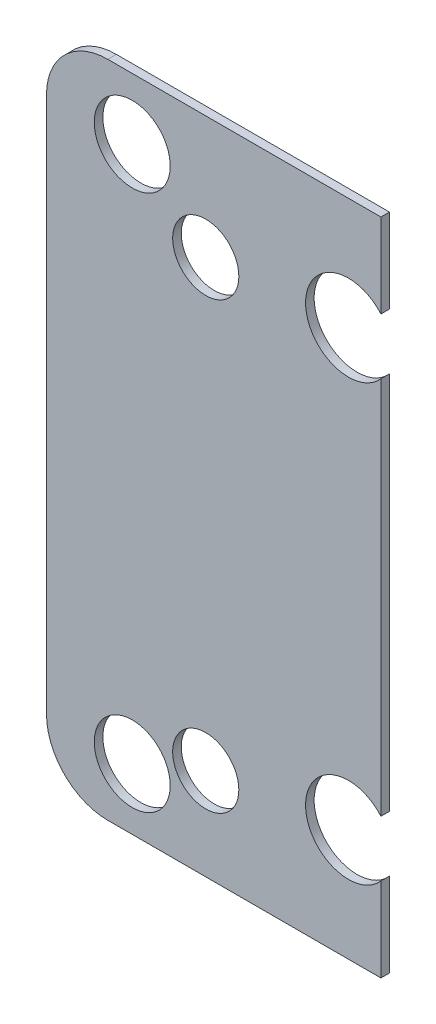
SolidWorks part; units mm, degrees
ref_plane "前基準面" through (0, 0, 0) normal (0, 0, 1) x (1, 0, 0)
ref_plane "上基準面" through (0, 0, 0) normal (0, 1, 0) x (1, 0, 0)
ref_plane "右基準面" through (0, 0, 0) normal (1, 0, 0) x (0, 0, -1)
sketch "草圖1" plane through (0, 0, 0) normal (0, 0, 1) x (1, 0, 0)
  line L1 (-38, 30) -> (38, 30)
  line L2 (-38, 30) -> (-38, -30)
  line L3 (-38, -30) -> (38, -30)
  line L4 (38, 30) -> (38, -30)
  line L5 (-38, 30) -> (38, -30) construction
  line L6 (-38, -30) -> (38, 30) construction
  point P0 (0, 0)
  point P28 (0, 0)
  dimension "D1" = 76
  dimension "D2" = 60
extrude "填料-伸長1" add sketch "草圖1" along normal blind 0.7
sketch "草圖2" plane through (0, 0, 0.7) normal (0, 0, 1) x (1, 0, 0)
  line L6 (0.3574, 0.005) -> (20.1903, 2.4807) construction
  line L7 (0.3574, -0.005) -> (20.1903, -2.4807) construction
  line L8 (0.3574, 0.005) -> (4.5094, 0.5233)
  line L9 (0.3574, -0.005) -> (4.5094, -0.5233)
  line L10 (6.1751, 0.8773) -> (19.0478, 4.7845)
  line L11 (6.1751, -0.8773) -> (19.0478, -4.7845)
  line L12 (-2.3278, -5.7864) -> (-5.3804, -18.8881)
  line L13 (-0.1744, -0.312) -> (-1.8015, -4.1669)
  line L14 (-0.183, -0.307) -> (-2.7079, -3.6436)
  line L15 (-3.8473, -4.9091) -> (-13.6674, -14.1037)
  line L16 (-3.8473, 4.9091) -> (-13.6674, 14.1037)
  line L17 (-0.183, 0.307) -> (-2.7079, 3.6436)
  line L18 (-0.1744, 0.312) -> (-1.8015, 4.1669)
  line L19 (-2.3278, 5.7864) -> (-5.3804, 18.8881)
  circle A7 centre (0, 0) radius 0.353 construction
  arc A8 (0.3574, 0.005) -> (0.3574, -0.005) centre (0.358, 0) ccw
  arc A9 (19.0478, -4.7845) -> (19.0478, 4.7845) centre (20.5, 0) ccw
  circle A10 centre (20.5, 0) radius 2.5 construction
  arc A11 (4.5094, -0.5233) -> (6.1751, -0.8773) centre (3.2707, -10.4463) cw
  arc A12 (4.5094, 0.5233) -> (6.1751, 0.8773) centre (3.2707, 10.4463) ccw
  arc A13 (-13.6674, -14.1037) -> (-5.3804, -18.8881) centre (-10.25, -17.7535) ccw
  arc A14 (-1.8015, -4.1669) -> (-2.3278, -5.7864) centre (7.4114, -8.0556) ccw
  arc A15 (-0.1744, -0.312) -> (-0.183, -0.307) centre (-0.179, -0.31) ccw
  arc A16 (-2.7079, -3.6436) -> (-3.8473, -4.9091) centre (-10.6821, 2.3906) cw
  arc A17 (-5.3804, 18.8881) -> (-13.6674, 14.1037) centre (-10.25, 17.7535) ccw
  arc A18 (-2.7079, 3.6436) -> (-3.8473, 4.9091) centre (-10.6821, -2.3906) ccw
  arc A19 (-0.183, 0.307) -> (-0.1744, 0.312) centre (-0.179, 0.31) ccw
  arc A20 (-1.8015, 4.1669) -> (-2.3278, 5.7864) centre (7.4114, 8.0556) cw
  point P17 (5.3574, -0.6291)
  point P20 (5.3574, 0.6291)
  point P46 (0, 0)
  dimension "D1" = 0.706
  dimension "D2" = 0.01
  dimension "D3" = 10
  dimension "D6" = 5
  dimension "D4" = 5
  dimension "D7" = 10
  dimension "D9" = 0.6201
  dimension "D5" = 20.5
  dimension "D8" = 3
sketch "草圖5" plane through (0, 0, 0.7) normal (0, 0, 1) x (1, 0, 0)
  line L0 (-29.9, 26.9) -> (29.9, 26.9)
  line L1 (-38, 30) -> (-38, -30) construction
  line L2 (38, -30) -> (38, 30) construction
  line L3 (34.9, 21.9) -> (34.9, -21.9)
  line L4 (38, 30) -> (-38, 30) construction
  line L5 (-38, -30) -> (38, -30) construction
  line L6 (-29.9, -26.9) -> (29.9, -26.9)
  line L7 (-34.9, 21.9) -> (-34.9, -21.9)
  arc A0 (-29.9, -26.9) -> (-34.9, -21.9) centre (-29.9, -21.9) cw
  arc A1 (34.9, -21.9) -> (29.9, -26.9) centre (29.9, -21.9) cw
  arc A2 (29.9, 26.9) -> (34.9, 21.9) centre (29.9, 21.9) cw
  arc A3 (-34.9, 21.9) -> (-29.9, 26.9) centre (-29.9, 21.9) cw
  dimension "D5" = 5
  dimension "D1" = 3.1
  dimension "D2" = 3.1
  dimension "D3" = 3.1
  dimension "D4" = 3.1
extrude "除料-伸長4" cut sketch "草圖5" against normal blind 10 contours L7 A3 L0 A2 L3 A1 L6 A0 M32 M29 M30 M31
ref_plane "平面1" through (0, 0, 0.7) normal (0, 0, 1) x (1, 0, 0)
sketch "草圖9" plane through (0, 0, 0.7) normal (0, 0, 1) x (1, 0, 0)
  line L0 (34.9, 21.9) -> (24.9, 21.9) construction
  line L1 (24.9, 21.9) -> (24.9, -21.9) construction
  line L2 (24.9, -21.9) -> (34.9, -21.9) construction
  line L3 (34.9, 21.9) -> (34.9, -21.9) construction
  line L4 (0, 26.9) -> (0, -26.9) construction
  line L5 (-29.9, 26.9) -> (29.9, 26.9) construction
  line L6 (-29.9, -26.9) -> (29.9, -26.9) construction
  line L7 (34.9, 0) -> (-34.9, 0) construction
  line L8 (-34.9, 21.9) -> (-34.9, -21.9) construction
  circle A0 centre (32.1, 17.9) radius 1.5
  circle A3 centre (-32.1, 19.4) radius 1.5
  circle A4 centre (-32.1, -19.4) radius 1.5
  circle A5 centre (32.1, -19.4) radius 1.5
  dimension "D2" = 3
  dimension "D5" = 2.8
  dimension "D3" = 3
  dimension "D7" = 2.8
  dimension "D1" = 10
  dimension "D4" = 4
  dimension "D6" = 2.5
sketch "草圖13" plane through (0, 0, 0.7) normal (0, 0, 1) x (1, 0, 0)
  line L0 (5.358, 0.6292) -> (19.0478, 4.7845) construction
  line L1 (0.3574, 0.005) -> (20.1903, 2.4807) construction
  line L2 (20.1903, -2.4807) -> (0.3574, -0.005) construction
  line L15 (0.3574, 0.005) -> (5.358, 0.6292) construction
  line L16 (0.3574, -0.005) -> (5.358, -0.6292) construction
  line L17 (5.358, -0.6292) -> (19.0478, -4.7845) construction
  line L18 (-2.1341, -4.9548) -> (-5.3804, -18.8881) construction
  line L19 (-0.1744, -0.312) -> (-2.1341, -4.9548) construction
  line L20 (-0.183, -0.307) -> (-3.2239, -4.3256) construction
  line L21 (-3.2239, -4.3256) -> (-13.6673, -14.1036) construction
  line L22 (-3.2239, 4.3256) -> (-13.6673, 14.1036) construction
  line L23 (-0.183, 0.307) -> (-3.2239, 4.3256) construction
  line L24 (-0.1744, 0.312) -> (-2.1341, 4.9548) construction
  line L25 (-2.1341, 4.9548) -> (-5.3804, 18.8881) construction
  line L41 (0.3574, 0.005) -> (6.1962, 1.0512)
  line L42 (0.3574, -0.005) -> (6.1962, -1.0512)
  line L43 (-0.183, -0.307) -> (-4.0085, -4.8405)
  line L44 (-0.1744, -0.312) -> (-2.1877, -5.8917)
  line L45 (-0.1744, 0.312) -> (-2.1877, 5.8917)
  line L46 (-0.183, 0.307) -> (-4.0085, 4.8405)
  circle A8 centre (0, 0) radius 0.353 construction
  arc A9 (0.3574, 0.005) -> (0.3574, -0.005) centre (0.358, 0) ccw construction
  circle A10 centre (20.5, 0) radius 2.5 construction
  arc A11 (19.0478, -4.7845) -> (19.0478, 4.7845) centre (20.5, 0) ccw construction
  arc A12 (-13.6673, -14.1036) -> (-5.3804, -18.8881) centre (-10.25, -17.7535) ccw construction
  arc A13 (-0.1744, -0.312) -> (-0.183, -0.307) centre (-0.179, -0.31) ccw construction
  arc A14 (-5.3804, 18.8881) -> (-13.6673, 14.1036) centre (-10.25, 17.7535) ccw construction
  arc A15 (-0.183, 0.307) -> (-0.1744, 0.312) centre (-0.179, 0.31) ccw construction
  arc A16 (-4.7391, 4.8766) -> (-4.7391, -4.8766) centre (0, 0) ccw
  arc A17 (-0.183, 0.307) -> (-0.1744, 0.312) centre (-0.179, 0.31) ccw
  arc A18 (-0.1744, -0.312) -> (-0.183, -0.307) centre (-0.179, -0.31) ccw
  arc A19 (-1.8537, -6.5425) -> (6.5928, -1.6658) centre (0, 0) ccw
  arc A20 (0.3574, 0.005) -> (0.3574, -0.005) centre (0.358, 0) ccw
  arc A21 (6.5928, 1.6658) -> (-1.8537, 6.5425) centre (0, 0) ccw
  arc A22 (6.1962, -1.0512) -> (6.5928, -1.6658) centre (6.108, -1.5434) cw
  arc A23 (6.1962, 1.0512) -> (6.5928, 1.6658) centre (6.108, 1.5434) ccw
  arc A24 (-2.1877, 5.8917) -> (-1.8537, 6.5425) centre (-1.7174, 6.0614) cw
  arc A25 (-4.0085, 4.8405) -> (-4.7391, 4.8766) centre (-4.3906, 4.518) ccw
  arc A26 (-4.0085, -4.8405) -> (-4.7391, -4.8766) centre (-4.3906, -4.518) cw
  arc A27 (-2.1877, -5.8917) -> (-1.8537, -6.5425) centre (-1.7174, -6.0614) ccw
  point P31 (0, 0)
  point P38 (6.7034, -1.1421)
  point P41 (6.7034, 1.1421)
  point P49 (0, 0)
  dimension "D1" = 0.706
  dimension "D2" = 0.01
  dimension "D3" = 5
  dimension "D6" = 5
  dimension "D5" = 10
  dimension "D8" = 13.6
  dimension "D12" = 0.5
  dimension "D13" = 0.5
  dimension "D4" = 20.5
  dimension "D9" = 0.1
  dimension "D10" = 0.1
  dimension "D11" = 3
  dimension "D7" = 3
extrude "除料-伸長8" cut sketch "草圖13" against normal blind 0.7
sketch "草圖17" plane through (0, 0, 0.7) normal (0, 0, 1) x (1, 0, 0)
  line L0 (-29.9, 26.9) -> (29.9, 26.9) construction
  line L1 (-34.9, 21.9) -> (-34.9, -21.9) construction
  line L2 (0, 26.9) -> (0, -26.9) construction
  line L3 (-29.9, -26.9) -> (29.9, -26.9) construction
  circle A0 centre (-21.9, 16.9) radius 2.5
  circle A1 centre (21.9, 16.9) radius 2.5
  circle A2 centre (-21.9, -19.4) radius 2.5
  dimension "D3" = 5
  dimension "D4" = 5
  dimension "D1" = 10
  dimension "D2" = 13
  dimension "D5" = 7.5
extrude "除料-伸長9" cut sketch "草圖17" against normal through all
sketch "草圖20" plane through (0, 0, 0.7) normal (0, 0, 1) x (1, 0, 0)
  line L0 (20.1903, 2.4807) -> (0.3574, 0.005) construction
  line L1 (0.3574, -0.005) -> (20.1903, -2.4807) construction
  line L2 (0.3574, 0.005) -> (5.358, 0.6292)
  line L3 (0.3574, -0.005) -> (5.358, -0.6292)
  line L4 (5.358, 0.6292) -> (19.0478, 4.7845)
  line L5 (5.358, -0.6292) -> (19.0478, -4.7845)
  line L6 (-0.183, -0.307) -> (-3.2239, -4.3256)
  line L7 (-3.2239, -4.3256) -> (-13.6673, -14.1036)
  line L8 (-2.1341, -4.9548) -> (-5.3804, -18.8881)
  line L9 (-0.1744, -0.312) -> (-2.1341, -4.9548)
  line L10 (-7.9468, -18.7257) -> (-0.1744, -0.312) construction
  line L11 (-0.183, -0.307) -> (-12.2436, -16.245) construction
  line L12 (-0.1744, 0.312) -> (-2.1341, 4.9548)
  line L13 (-2.1341, 4.9548) -> (-5.3804, 18.8881)
  line L14 (-3.2239, 4.3256) -> (-13.6673, 14.1036)
  line L15 (-0.183, 0.307) -> (-3.2239, 4.3256)
  line L16 (-12.2436, 16.245) -> (-0.183, 0.307) construction
  line L17 (-0.1744, 0.312) -> (-7.9468, 18.7257) construction
  circle A0 centre (0, 0) radius 0.353 construction
  arc A1 (0.3574, 0.005) -> (0.3574, -0.005) centre (0.358, 0) ccw
  circle A2 centre (20.5, 0) radius 2.5 construction
  arc A3 (19.0478, -4.7845) -> (19.0478, 4.7845) centre (20.5, 0) ccw
  arc A4 (-0.1744, -0.312) -> (-0.183, -0.307) centre (-0.179, -0.31) ccw
  arc A5 (-13.6673, -14.1036) -> (-5.3804, -18.8881) centre (-10.25, -17.7535) ccw
  circle A6 centre (-10.25, -17.7535) radius 2.5 construction
  arc A7 (-0.183, 0.307) -> (-0.1744, 0.312) centre (-0.179, 0.31) ccw
  arc A8 (-5.3804, 18.8881) -> (-13.6673, 14.1036) centre (-10.25, 17.7535) ccw
  circle A9 centre (-10.25, 17.7535) radius 2.5 construction
  point P38 (0, 0)
  dimension "D1" = 0.706
  dimension "D2" = 0.01
  dimension "D3" = 5
  dimension "D5" = 10
  dimension "D4" = 20.5
  dimension "D6" = 5
  dimension "D7" = 3
ref_plane "平面5" through (0, 0, 0.7) normal (0, 0, 1) x (1, 0, 0)
sketch "草圖29" plane through (0, 0, 0.7) normal (0, 0, 1) x (1, 0, 0)
  line L0 (0, 26.9) -> (0, -26.9) construction
  line L1 (-29.9, 26.9) -> (29.9, 26.9) construction
  line L2 (-29.9, -26.9) -> (29.9, -26.9) construction
  line L3 (-34.9, 0) -> (34.9, 0) construction
  line L4 (-34.9, 21.9) -> (-34.9, -21.9) construction
  line L5 (34.9, 21.9) -> (34.9, -21.9) construction
  circle A0 centre (-27.9, 21.9) radius 3
  circle A1 centre (27.9, 21.9) radius 3
  circle A2 centre (27.9, -21.9) radius 3
  circle A3 centre (-27.9, -21.9) radius 3
  dimension "D1" = 6
  dimension "D2" = 5
  dimension "D3" = 7
extrude "填料-伸長3" add sketch "草圖29" along normal blind 0.6
sketch "草圖31" plane through (0, 0, 0.7) normal (0, 0, 1) x (1, 0, 0)
  line L3 (2.5, 40) -> (-2.5, 40)
  line L5 (-5, 37.5) -> (-5, -37.5)
  line L6 (2.5, -40) -> (-2.5, -40)
  line L10 (5, 37.5) -> (5, -37.5)
  line L18 (0, 40) -> (0, -40)
  line L19 (-5, 0) -> (5, 0)
  line L20 (0.353, 0) -> (0, 0)
  arc A0 (-2.4263, -34.8074) -> (2.5209, -34.8074) centre (0.0473, -34.445) ccw construction
  arc A1 (-2.5, 40) -> (-5, 37.5) centre (-2.5, 37.5) ccw
  arc A2 (-5, -37.5) -> (-2.5, -40) centre (-2.5, -37.5) ccw
  arc A3 (5, -37.5) -> (2.5, -40) centre (2.5, -37.5) cw
  arc A5 (-2.4263, -34.8074) -> (2.5209, -34.8074) centre (0.0473, -34.445) ccw construction
  arc A9 (2.5, 40) -> (5, 37.5) centre (2.5, 37.5) cw
  arc A10 (0.3574, 0.005) -> (0.3574, -0.005) centre (0.358, 0) ccw construction
extrude "除料-伸長18" cut sketch "草圖31" against normal mid plane 10 contours L3 A1 L5 L18 M56 | A9 L3 L18 L10 M56 | L18 L5 M56 M36 M37 M38 M39 M40 M41 M42 | L18 L10 M56 M42 | L18 L5 M30 M31 M32 M33 M34 M35 M36 M52 | L5 L19 L18 M42 M41 M40 M39 M38 M37 M36 | L19 L5 L18 M36 M35 M34 M33 M32 M31 M30 | L19 L18 L10 M30 M28 M27 | L18 L19 L10 M27 M44 M42 | L18 L10 M30 M52 | L5 A2 L6 L18 M52 | A3 L10 L18 L6 M52
sketch "草圖33" plane through (0, 0, 0.7) normal (0, 0, 1) x (1, 0, 0)
  circle A0 centre (-27.9, 21.9) radius 3.2
  circle A1 centre (-27.9, -21.9) radius 3.2
  circle A2 centre (27.9, -21.9) radius 3.2
  circle A3 centre (27.9, 21.9) radius 3.2
  dimension "D1" = 6.4
  dimension "D2" = 6.4
sketch "草圖34" plane through (0, 0, 0.7) normal (0, 0, 1) x (1, 0, 0)
  circle A1 centre (20.5, 0) radius 3
  circle A2 centre (-10.25, 17.7535) radius 3.5
  circle A3 centre (-10.25, -17.7535) radius 3.5
  dimension "D1" = 6
  dimension "D2" = 7
  dimension "D3" = 7
extrude "除料-伸長22" cut sketch "草圖34" against normal mid plane 10 contours A2 | A3 | A1
extrude "除料-伸長23" cut sketch "草圖33" against normal mid plane 10 contours A0 | A3 | A2 | A1
sketch "草圖35" plane through (0, 0, 0.7) normal (0, 0, 1) x (1, 0, 0)
  circle A0 centre (21.9, 16.9) radius 2.6
  circle A1 centre (-21.9, 16.9) radius 2.6
  circle A2 centre (-21.9, -19.4) radius 2.6
extrude "除料-伸長24" cut sketch "草圖35" against normal blind 10
sketch "草圖36" plane through (0, 0, 0.7) normal (0, 0, 1) x (1, 0, 0)
sketch "草圖37" plane through (0, 0, 0.7) normal (0, 0, 1) x (1, 0, 0)
  line L4 (5, 26.9) -> (5, 4.6087)
  line L11 (5, -26.9) -> (29.9, -26.9)
  line L12 (34.9, -21.9) -> (34.9, 21.9)
  line L13 (29.9, 26.9) -> (5, 26.9)
  line L18 (5, -26.9) -> (29.9, -26.9)
  line L19 (34.9, -21.9) -> (34.9, 21.9)
  line L20 (29.9, 26.9) -> (5, 26.9)
  line L38 (5, 26.9) -> (5, 4.6087)
  line L39 (6.1962, 1.0512) -> (0.3574, 0.005)
  line L40 (6.1962, 1.0512) -> (0.3574, 0.005)
  line L41 (0.3574, -0.005) -> (6.1962, -1.0512)
  line L42 (0.3574, -0.005) -> (6.1962, -1.0512)
  line L43 (5, -4.6087) -> (5, -26.9)
  line L44 (5, -4.6087) -> (5, -26.9)
  arc A3 (6.5928, 1.6658) -> (5, 4.6087) centre (0, 0) ccw
  arc A8 (29.9, -26.9) -> (34.9, -21.9) centre (29.9, -21.9) ccw
  arc A9 (34.9, 21.9) -> (29.9, 26.9) centre (29.9, 21.9) ccw
  arc A13 (29.9, -26.9) -> (34.9, -21.9) centre (29.9, -21.9) ccw
  arc A14 (34.9, 21.9) -> (29.9, 26.9) centre (29.9, 21.9) ccw
  arc A27 (6.5928, 1.6658) -> (5, 4.6087) centre (0, 0) ccw
  arc A32 (6.1962, 1.0512) -> (6.5928, 1.6658) centre (6.108, 1.5434) ccw
  arc A33 (6.1962, 1.0512) -> (6.5928, 1.6658) centre (6.108, 1.5434) ccw
  arc A34 (0.3574, 0.005) -> (0.3574, -0.005) centre (0.358, 0) ccw
  arc A35 (0.3574, 0.005) -> (0.3574, -0.005) centre (0.358, 0) ccw
  arc A36 (6.5928, -1.6658) -> (6.1962, -1.0512) centre (6.108, -1.5434) ccw
  arc A37 (6.5928, -1.6658) -> (6.1962, -1.0512) centre (6.108, -1.5434) ccw
  arc A38 (5, -4.6087) -> (6.5928, -1.6658) centre (0, 0) ccw
  arc A39 (5, -4.6087) -> (6.5928, -1.6658) centre (0, 0) ccw
  dimension "D1" = 0
extrude "除料-伸長27" cut sketch "草圖37" against normal blind 10 contours L18 A13 L19 A14 L20 L38 A27 A33 L40 A35 L42 A37 A39 L44
sketch "草圖41" plane through (0, 0, 1.3) normal (0, 0, 1) x (1, 0, 0)
  circle A0 centre (-27.9, -21.9) radius 3.1
  circle A1 centre (-27.9, 21.9) radius 3.1
  dimension "D1" = 6.2
  dimension "D2" = 6.2
extrude "除料-伸長34" cut sketch "草圖41" against normal blind 10
sketch "草圖42" plane through (0, 0, 0.7) normal (0, 0, 1) x (1, 0, 0)
  line L0 (-5, 4.6087) -> (-5, -4.6087)
  line L1 (-7.6, -26.9) -> (-7.6, -4.6087)
  line L2 (-7.6, 4.6087) -> (-7.6, -4.6087)
  line L3 (-7.6, 4.6087) -> (-7.6, 26.9)
  line L5 (-5, 4.6087) -> (-5, 26.9)
  line L6 (-5, 26.9) -> (-29.9, 26.9)
  line L7 (-34.9, 21.9) -> (-34.9, -21.9)
  line L8 (-29.9, -26.9) -> (-5, -26.9)
  line L9 (-5, -26.9) -> (-5, -4.6087)
  line L10 (-5, 4.6087) -> (-5, 26.9)
  line L11 (-5, 26.9) -> (-29.9, 26.9)
  line L12 (-34.9, 21.9) -> (-34.9, -21.9)
  line L13 (-29.9, -26.9) -> (-5, -26.9)
  line L14 (-5, -26.9) -> (-5, -4.6087)
  arc A3 (-29.9, 26.9) -> (-34.9, 21.9) centre (-29.9, 21.9) ccw
  arc A4 (-34.9, -21.9) -> (-29.9, -26.9) centre (-29.9, -21.9) ccw
  arc A5 (-5, 4.6087) -> (-5, -4.6087) centre (0, 0) ccw
  arc A6 (-29.9, 26.9) -> (-34.9, 21.9) centre (-29.9, 21.9) ccw
  arc A7 (-34.9, -21.9) -> (-29.9, -26.9) centre (-29.9, -21.9) ccw
  arc A8 (-5, 4.6087) -> (-5, -4.6087) centre (0, 0) ccw
  dimension "D1" = 0
  dimension "D2" = 2.6
extrude "除料-伸長35" cut sketch "草圖42" against normal blind 10 contours L3 L2 M23 M16 M17 | L2 L1 M23 M21 M22
sketch "草圖43" plane through (0, 0, 0.7) normal (0, 0, 1) x (1, 0, 0)
  circle A0 centre (-21.9, 16.9) radius 2.7
  circle A1 centre (-21.9, -19.4) radius 2.7
  dimension "D1" = 5.4
  dimension "D2" = 5.4
extrude "除料-伸長36" cut sketch "草圖43" against normal through all contours A1 | A0
extrude "除料-伸長37" cut sketch "草圖44" against normal blind 0.5
sketch "草圖44" [suppressed] plane through (0, 0, 0) normal (0, 0, -1) x (-1, 0, 0)
  circle A3 centre (26.6, 0) radius 1.1
  circle A4 centre (20.5, -6.1) radius 1.1
  circle A5 centre (20.5, 6.1) radius 1.1
  circle A8 centre (-10.67, 23.8535) radius 1.1
  circle A9 centre (-16.2412, 18.9005) radius 1.1
  circle A10 centre (-10.6517, 9.7731) radius 1.1
  circle A11 centre (-10.67, -23.8535) radius 1.1
  circle A12 centre (-16.2412, -18.9005) radius 1.1
  circle A13 centre (-13.5886, -12.523) radius 1.1
